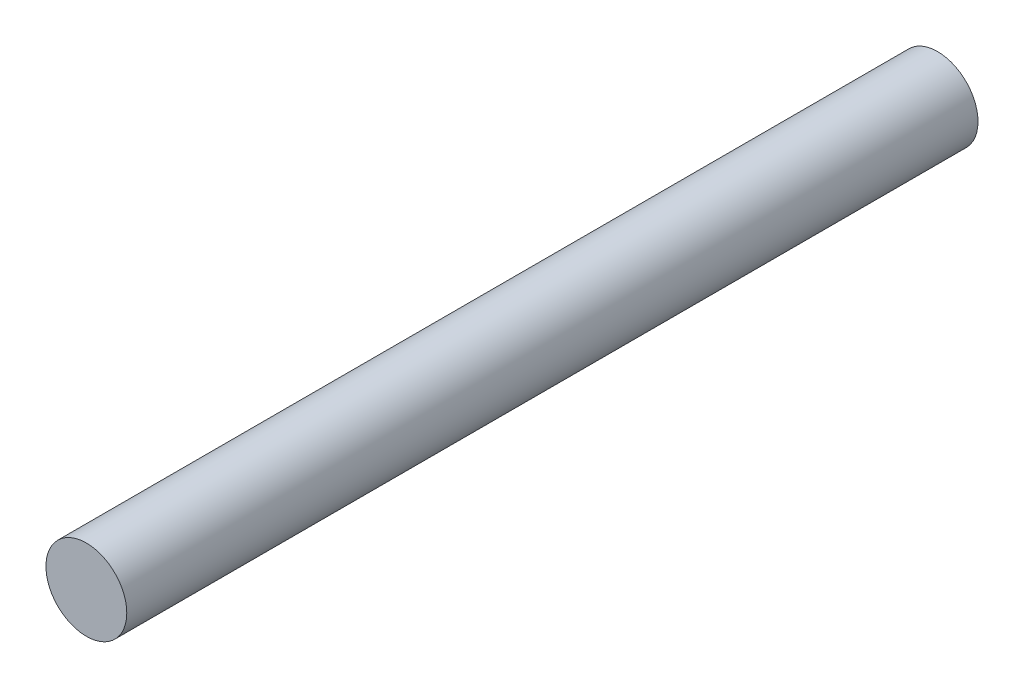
SolidWorks part; units mm, degrees
ref_plane "Front Plane" through (0, 0, 0) normal (0, 0, 1) x (1, 0, 0)
ref_plane "Top Plane" through (0, 0, 0) normal (0, 1, 0) x (1, 0, 0)
ref_plane "Right Plane" through (0, 0, 0) normal (1, 0, 0) x (0, 0, -1)
sketch "Sketch1" plane through (0, 0, 0) normal (0, 0, 1) x (1, 0, 0)
  circle A0 centre (0, 0) radius 4.826
  dimension "D1" = 9.652
extrude "Boss-Extrude1" add sketch "Sketch1" along normal blind 101.6
